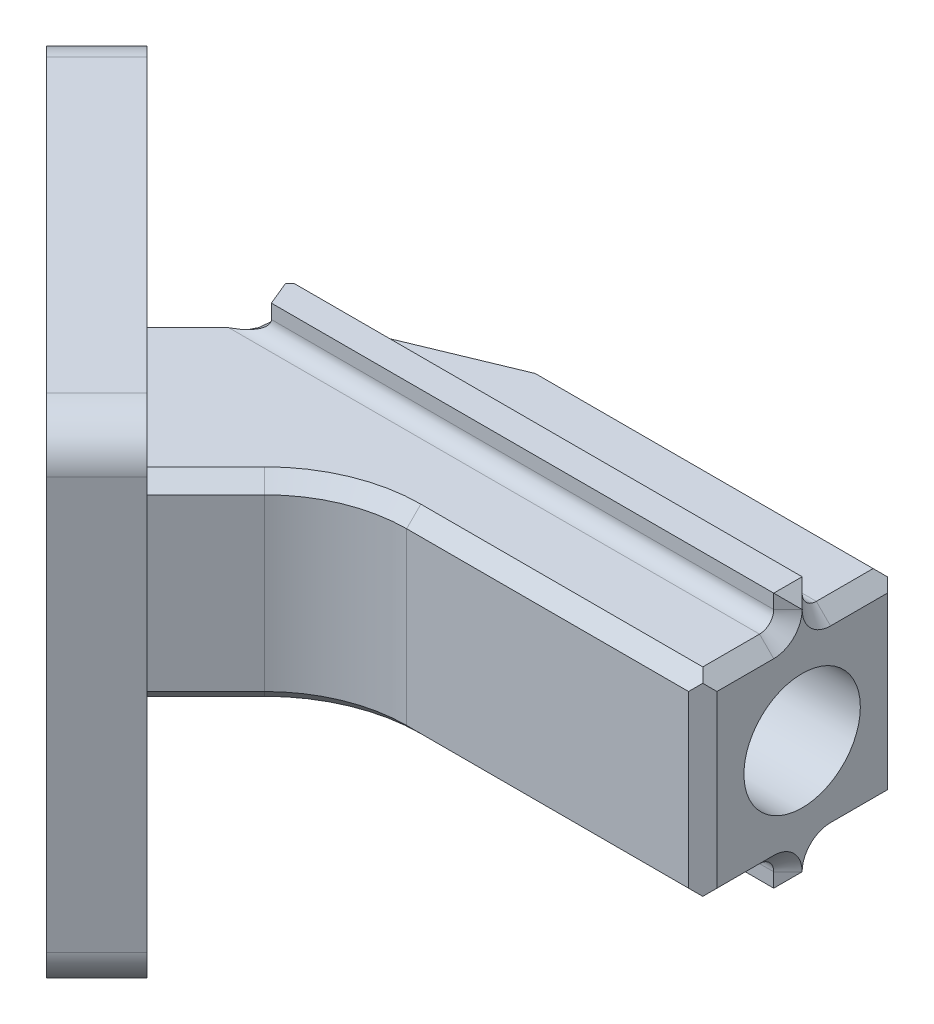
SolidWorks part; units mm, degrees
ref_plane "Front Plane" through (0, 0, 0) normal (0, 0, 1) x (1, 0, 0)
ref_plane "Top Plane" through (0, 0, 0) normal (0, 1, 0) x (1, 0, 0)
ref_plane "Right Plane" through (0, 0, 0) normal (1, 0, 0) x (0, 0, -1)
sketch "Sketch1" plane through (0, 0, 0) normal (0, 1, 0) x (1, 0, 0)
  line L0 (0, 0) -> (-7.0711, -7.0711)
  line L1 (0, 0) -> (25, 0)
  line L2 (0, 0) -> (0, 14)
  line L3 (0, 14) -> (25, 14)
  line L4 (25, 0) -> (25, 14)
  line L5 (-7.0711, -7.0711) -> (-16.9706, 2.8284)
  line L6 (0, 0) -> (-9.8995, 9.8995)
  line L7 (-9.8995, 9.8995) -> (-17.0763, 2.7226)
  line L8 (-9.8995, 9.8995) -> (0, 14)
  dimension "D1" = 25
  dimension "D2" = 14
  dimension "D3" = 135
  dimension "D4" = 10
  dimension "D5" = 14
  dimension "D6" = 14
extrude "Boss-Extrude1" add sketch "Sketch1" along normal blind 14 contours L1 L4 L3 L2 | L8 L6 L2 | L6 L7 L5 L0
sketch "Sketch2" plane through (25, 0, 0) normal (1, 0, 0) x (0, 0, -1)
  line L0 (0, 14) -> (0, 0) construction
  line L1 (0, 14) -> (14, 14) construction
  circle A0 centre (7, 7) radius 4.1
  dimension "D1" = 8.2
  dimension "D2" = 7
  dimension "D3" = 7
extrude "Cut-Extrude1" cut sketch "Sketch2" against normal blind 20
fillet "Fillet1" radius 10 1 edges at (0, 7, 0)
sketch "Sketch3" plane through (-7.0711, 0, 7.0711) normal (-0.7071, 0, 0.7071) x (0.7071, 0, 0.7071)
  line L1 (-24.5, 24.5) -> (10.5, 24.5)
  line L2 (-24.5, 24.5) -> (-24.5, -10.5)
  line L3 (-24.5, -10.5) -> (10.5, -10.5)
  line L4 (10.5, 24.5) -> (10.5, -10.5)
  line L5 (-24.5, 24.5) -> (10.5, -10.5) construction
  line L6 (-24.5, -10.5) -> (10.5, 24.5) construction
  line L8 (-14, 14) -> (-14, 0) construction
  line L9 (0, 14) -> (-14, 14) construction
  point P0 (-7, 7)
  dimension "D1" = 7
  dimension "D2" = 7
  dimension "D3" = 35
  dimension "D4" = 35
extrude "Boss-Extrude2" add sketch "Sketch3" along normal blind 5
sketch "Sketch4" plane through (-7.0711, 0, 7.0711) normal (0.7071, 0, -0.7071) x (-0.7071, 0, -0.7071)
  line L1 (-8.5, 22.5) -> (22.5, 22.5)
  line L2 (-8.5, 22.5) -> (-8.5, -8.5)
  line L3 (-8.5, -8.5) -> (22.5, -8.5)
  line L4 (22.5, 22.5) -> (22.5, -8.5)
  line L5 (14, 14) -> (0, 14)
  line L6 (14, 14) -> (14, 0)
  line L7 (14, 0) -> (0, 0)
  line L8 (0, 14) -> (0, 0)
  line L9 (-10.5, 24.5) -> (24.5, 24.5) construction
  line L10 (24.5, 24.5) -> (24.5, -10.5) construction
  line L11 (24.5, -10.5) -> (-10.5, -10.5) construction
  line L12 (-10.5, -10.5) -> (-10.5, 24.5) construction
  line L13 (-8.5, 22.5) -> (22.5, -8.5) construction
  line L14 (-7.7929, 23.2071) -> (23.2071, -7.7929)
  line L15 (-9.2071, 21.7929) -> (21.7929, -9.2071)
  line L16 (22.5, 22.5) -> (-8.5, -8.5) construction
  line L17 (23.2071, 21.7929) -> (-7.7929, -9.2071)
  line L18 (21.7929, 23.2071) -> (-9.2071, -7.7929)
  arc A0 (-7.7929, 23.2071) -> (-9.2071, 21.7929) centre (-8.5, 22.5) ccw
  arc A1 (21.7929, -9.2071) -> (23.2071, -7.7929) centre (22.5, -8.5) ccw
  arc A2 (23.2071, 21.7929) -> (21.7929, 23.2071) centre (22.5, 22.5) ccw
  arc A3 (-9.2071, -7.7929) -> (-7.7929, -9.2071) centre (-8.5, -8.5) ccw
  point P17 (7, 7)
  point P22 (7, 7)
  dimension "D1" = 14
  dimension "D2" = 14
  dimension "D3" = 2
  dimension "D4" = 2
  dimension "D5" = 2
  dimension "D6" = 2
  dimension "D7" = 2
  dimension "D8" = 2
extrude "Cut-Extrude2" cut sketch "Sketch4" against normal blind 3 contours L18 L1 L14 L5 | L4 L17 L6 L14 | L18 L8 L15 L2 | L7 L17 L3 L15
fillet "Fillet2" radius 1 8 edges at (-23.0416, 22.5, -6.7782) (-24.0416, 21.0858, -7.7782) (-24.0416, -7.0858, -7.7782) (-23.0416, -8.5, -6.7782) (-3.1213, -8.5, 13.1421) (-2.1213, -7.0858, 14.1421) (-2.1213, 21.0858, 14.1421) (-3.1213, 22.5, 13.1421)
fillet "Fillet3" radius 1 8 edges at (-9.1317, 0, 7.1317) (-17.0312, 0, -0.7678) (-8.1317, 12.5858, 8.1317) (-8.1317, 1.4142, 8.1317) (-9.1317, 14, 7.1317) (-17.0312, 14, -0.7678) (-18.0312, 12.5858, -1.7678) (-18.0312, 1.4142, -1.7678)
fillet "Fillet4" radius 3 4 edges at (-26.163, 24.5, -8.4853) (-1.4142, 24.5, 16.2635) (-1.4142, -10.5, 16.2635) (-26.163, -10.5, -8.4853)
sketch "Sketch5" plane through (0, 14, 0) normal (0, 1, 0) x (1, 0, 0)
  line L0 (25, 8) -> (-11.799, 8)
  line L1 (25, 0) -> (25, 14) construction
  line L2 (0, 14) -> (25, 14) construction
  line L3 (25, 6) -> (-13.799, 6)
  line L4 (4.1421, 0) -> (25, 0) construction
  line L5 (-11.799, 8) -> (-13.799, 6)
  line L6 (-9.8995, 9.8995) -> (-16.9706, 2.8284) construction
  line L7 (25, 8) -> (25, 6)
  dimension "D1" = 6
  dimension "D2" = 6
extrude "Boss-Extrude3" add sketch "Sketch5" along normal blind 2
sketch "Sketch6" plane through (0, 0, 0) normal (0, -1, 0) x (-1, 0, 0)
  line L0 (-25, 6) -> (13.799, 6)
  line L1 (-25, 0) -> (-25, 14) construction
  line L2 (9.8995, 9.8995) -> (16.9706, 2.8284) construction
  line L3 (-25, 8) -> (11.799, 8)
  line L4 (-4.1421, 0) -> (-25, 0) construction
  line L5 (0, 14) -> (-25, 14) construction
  line L6 (13.799, 6) -> (11.799, 8)
  line L7 (-25, 6) -> (-25, 8)
  dimension "D1" = 6
  dimension "D2" = 6
extrude "Boss-Extrude4" add sketch "Sketch6" along normal blind 2
fillet "Fillet5" radius 1 4 edges at (6.6005, 14, -8) (5.6005, 14, -6) (5.6005, 0, -6) (6.6005, 0, -8)
chamfer "Chamfer1" distance 1 angle 45 16 edges at (-13.799, -1.5, -6) (-14.0919, -0.2929, -5.7071) (-15.8848, 0, -3.9142) (-13.799, 15.5, -6) (-14.0919, 14.2929, -5.7071) (-15.8848, 14, -3.9142) (12.5, 0, -14) (12.5, 14, -14) (-4.9497, 0, -11.9497) (-4.9497, 14, -11.9497) (14.5711, 0, 0) (0.3153, 0, 0.7612) (-5, 0, 5) (-5, 14, 5) (0.3153, 14, 0.7612) (14.5711, 14, 0)
chamfer "Chamfer2" distance 1 angle 45 16 edges at (25, -2, -7) (25, 16, -7) (25, 15.5, -6) (25, 14.2929, -5.7071) (25, 14, -3) (25, -1.5, -6) (25, -0.2929, -5.7071) (25, 0, -3) (25, 7, 0) (25, 15.5, -8) (25, 14.2929, -8.2929) (25, 14, -11) (25, -1.5, -8) (25, -0.2929, -8.2929) (25, 0, -11) (25, 7, -14)
sketch "Sketch8" plane through (5, 0, 0) normal (1, 0, 0) x (0, 0, -1)
  circle A0 centre (7, 7) radius 2
  dimension "D1" = 4
extrude "Cut-Extrude3" cut sketch "Sketch8" against normal blind 25
